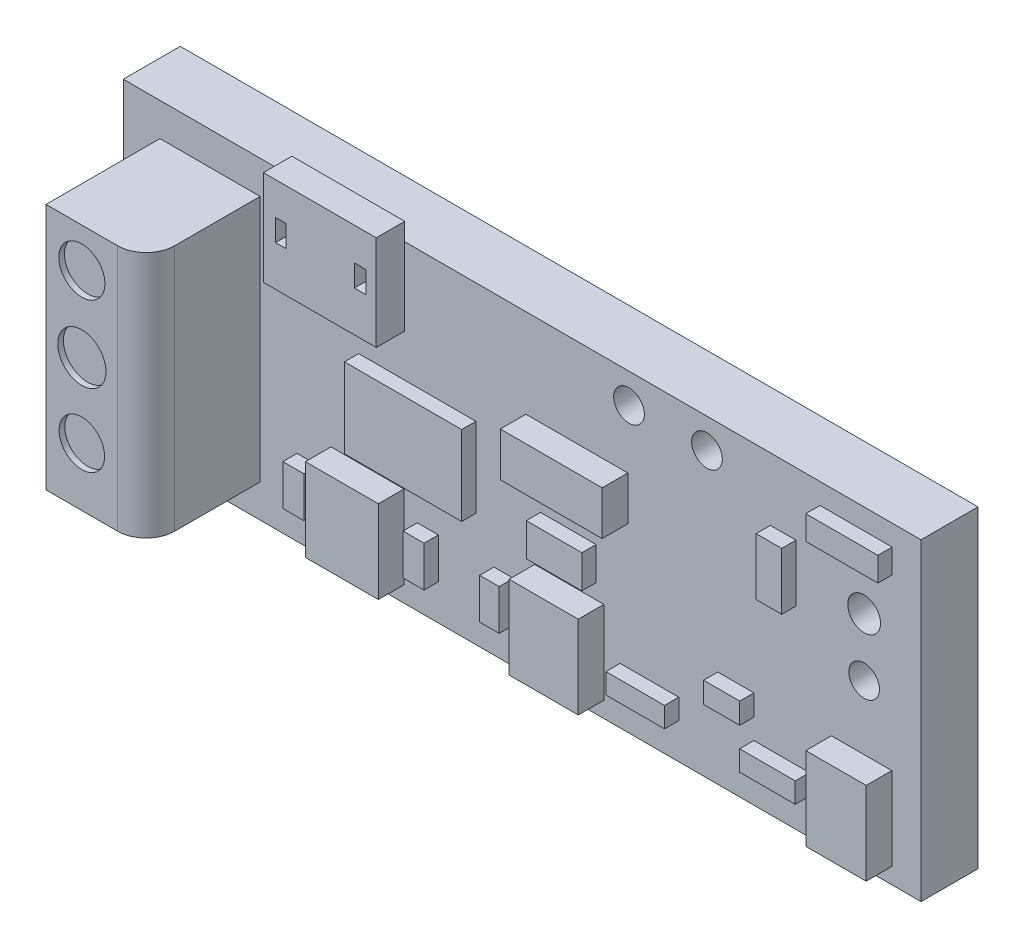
SolidWorks part; units mm, degrees
ref_plane "정면" through (0, 0, 0) normal (0, 0, 1) x (1, 0, 0)
ref_plane "윗면" through (0, 0, 0) normal (0, 1, 0) x (1, 0, 0)
ref_plane "우측면" through (0, 0, 0) normal (1, 0, 0) x (0, 0, -1)
sketch "스케치1" plane through (0, 0, 0) normal (0, 0, 1) x (1, 0, 0)
  line L1 (-16.6516, 33.6659) -> (-13.8516, 33.6659)
  line L2 (-16.6516, 33.6659) -> (-16.6516, 32.5659)
  line L3 (-16.6516, 32.5659) -> (-13.8516, 32.5659)
  line L4 (-13.8516, 33.6659) -> (-13.8516, 32.5659)
  line L5 (-16.6516, 33.6659) -> (-13.8516, 32.5659) construction
  line L6 (-16.6516, 32.5659) -> (-13.8516, 33.6659) construction
  point P0 (-15.2516, 33.1159)
extrude "보스-돌출1" add sketch "스케치1" along normal blind 0.2
sketch "스케치2" plane through (0, 0, 0.2) normal (0, 0, 1) x (1, 0, 0)
  line L1 (-16.5228, 33.5498) -> (-16.1713, 33.5498)
  line L2 (-16.5228, 33.5498) -> (-16.5228, 32.6819)
  line L3 (-16.5228, 32.6819) -> (-16.1713, 32.6819)
  line L4 (-16.1713, 33.5498) -> (-16.1713, 32.6819)
  line L5 (-16.5228, 33.5498) -> (-16.1713, 32.6819) construction
  line L6 (-16.5228, 32.6819) -> (-16.1713, 33.5498) construction
  point P0 (-16.347, 33.1159)
extrude "보스-돌출2" add sketch "스케치2" along normal blind 0.4
fillet "필렛2" radius 0.1 1 edges at (-16.1713, 33.1159, 0.6)
sketch "스케치3" plane through (0, 0, 0.2) normal (0, 0, 1) x (1, 0, 0)
  line L1 (-16.0598, 33.7279) -> (-15.6637, 33.7279)
  line L2 (-16.0598, 33.7279) -> (-16.0598, 33.3943)
  line L3 (-16.0598, 33.3943) -> (-15.6637, 33.3943)
  line L4 (-15.6637, 33.7279) -> (-15.6637, 33.3943)
  line L5 (-16.0598, 33.7279) -> (-15.6637, 33.3943) construction
  line L6 (-16.0598, 33.3943) -> (-15.6637, 33.7279) construction
  point P0 (-15.8617, 33.5611)
extrude "보스-돌출3" add sketch "스케치3" along normal blind 0.1
sketch "스케치4" plane through (0, 0, 0.3) normal (0, 0, 1) x (1, 0, 0)
  line L1 (-16.017, 33.613) -> (-15.9805, 33.613)
  line L2 (-16.017, 33.613) -> (-16.017, 33.5365)
  line L3 (-16.017, 33.5365) -> (-15.9805, 33.5365)
  line L4 (-15.9805, 33.613) -> (-15.9805, 33.5365)
  line L5 (-15.7406, 33.613) -> (-15.6989, 33.613)
  line L6 (-15.7406, 33.613) -> (-15.7406, 33.5365)
  line L7 (-15.7406, 33.5365) -> (-15.6989, 33.5365)
  line L8 (-15.6989, 33.613) -> (-15.6989, 33.5365)
extrude "컷-돌출1" cut sketch "스케치4" against normal blind 0.05
sketch "스케치5" plane through (0, 0, 0.2) normal (0, 0, 1) x (1, 0, 0)
  line L1 (-16.0416, 32.8335) -> (-15.9677, 32.8335)
  line L2 (-16.0416, 32.8335) -> (-16.0416, 32.6911)
  line L3 (-16.0416, 32.6911) -> (-15.9677, 32.6911)
  line L4 (-15.9677, 32.8335) -> (-15.9677, 32.6911)
  line L5 (-15.6196, 32.8335) -> (-15.5458, 32.8335)
  line L6 (-15.6196, 32.8335) -> (-15.6196, 32.6911)
  line L7 (-15.6196, 32.6911) -> (-15.5458, 32.6911)
  line L8 (-15.5458, 32.8335) -> (-15.5458, 32.6911)
  line L9 (-15.3506, 32.8335) -> (-15.2821, 32.8335)
  line L10 (-15.3506, 32.8335) -> (-15.3506, 32.6911)
  line L11 (-15.3506, 32.6911) -> (-15.2821, 32.6911)
  line L12 (-15.2821, 32.8335) -> (-15.2821, 32.6911)
  line L13 (-14.9076, 32.7623) -> (-14.7019, 32.7623)
  line L14 (-14.9076, 32.7623) -> (-14.9076, 32.6911)
  line L15 (-14.9076, 32.6911) -> (-14.7019, 32.6911)
  line L16 (-14.7019, 32.7623) -> (-14.7019, 32.6911)
  line L17 (-14.4382, 32.7623) -> (-14.243, 32.7623)
  line L18 (-14.4382, 32.7623) -> (-14.4382, 32.6911)
  line L19 (-14.4382, 32.6911) -> (-14.243, 32.6911)
  line L20 (-14.243, 32.7623) -> (-14.243, 32.6911)
  line L21 (-14.5647, 32.9073) -> (-14.4382, 32.9073)
  line L22 (-14.5647, 32.9073) -> (-14.5647, 32.8335)
  line L23 (-14.5647, 32.8335) -> (-14.4382, 32.8335)
  line L24 (-14.4382, 32.9073) -> (-14.4382, 32.8335)
  line L25 (-14.3801, 33.4453) -> (-14.2905, 33.4453)
  line L26 (-14.3801, 33.4453) -> (-14.3801, 33.2449)
  line L27 (-14.3801, 33.2449) -> (-14.2905, 33.2449)
  line L28 (-14.2905, 33.4453) -> (-14.2905, 33.2449)
  line L29 (-14.2061, 33.593) -> (-13.9529, 33.593)
  line L30 (-14.2061, 33.593) -> (-14.2061, 33.5086)
  line L31 (-14.2061, 33.5086) -> (-13.9529, 33.5086)
  line L32 (-13.9529, 33.593) -> (-13.9529, 33.5086)
  line L33 (-15.1871, 33.0814) -> (-14.992, 33.0814)
  line L34 (-15.1871, 33.0814) -> (-15.1871, 32.9653)
  line L35 (-15.1871, 32.9653) -> (-14.992, 32.9653)
  line L36 (-14.992, 33.0814) -> (-14.992, 32.9653)
  line L37 (-15.8253, 33.2449) -> (-15.4139, 33.2449)
  line L38 (-15.8253, 33.2449) -> (-15.8253, 32.9653)
  line L39 (-15.8253, 32.9653) -> (-15.4139, 32.9653)
  line L40 (-15.4139, 33.2449) -> (-15.4139, 32.9653)
extrude "보스-돌출4" add sketch "스케치5" along normal blind 0.05
sketch "스케치6" plane through (0, 0, 0.2) normal (0, 0, 1) x (1, 0, 0)
  line L1 (-15.9223, 32.913) -> (-15.6664, 32.913)
  line L2 (-15.9223, 32.913) -> (-15.9223, 32.6217)
  line L3 (-15.9223, 32.6217) -> (-15.6664, 32.6217)
  line L4 (-15.6664, 32.913) -> (-15.6664, 32.6217)
  line L5 (-15.2074, 32.913) -> (-14.9647, 32.913)
  line L6 (-15.2074, 32.913) -> (-15.2074, 32.6217)
  line L7 (-15.2074, 32.6217) -> (-14.9647, 32.6217)
  line L8 (-14.9647, 32.913) -> (-14.9647, 32.6217)
  line L9 (-14.166, 32.913) -> (-13.9542, 32.913)
  line L10 (-14.166, 32.913) -> (-14.166, 32.6217)
  line L11 (-14.166, 32.6217) -> (-13.9542, 32.6217)
  line L12 (-13.9542, 32.913) -> (-13.9542, 32.6217)
  line L13 (-15.2383, 33.3543) -> (-14.8809, 33.3543)
  line L14 (-15.2383, 33.3543) -> (-15.2383, 33.1998)
  line L15 (-15.2383, 33.1998) -> (-14.8809, 33.1998)
  line L16 (-14.8809, 33.3543) -> (-14.8809, 33.1998)
extrude "보스-돌출5" add sketch "스케치6" along normal blind 0.09
sketch "스케치7" plane through (0, 0, 0.2) normal (0, 0, 1) x (1, 0, 0)
  circle A0 centre (-14.8765, 33.5617) radius 0.0539
  circle A1 centre (-14.6029, 33.5617) radius 0.0539
  circle A2 centre (-14.0512, 33.341) radius 0.0575
  circle A3 centre (-14.0512, 33.138) radius 0.0539
extrude "컷-돌출2" cut sketch "스케치7" against normal blind 0.2
sketch "스케치8" plane through (0, 0, 0.6) normal (0, 0, 1) x (1, 0, 0)
  circle A0 centre (-16.397, 33.4116) radius 0.081
  circle A1 centre (-16.397, 33.1469) radius 0.0846
  circle A2 centre (-16.397, 32.8865) radius 0.08
extrude "컷-돌출3" cut sketch "스케치8" against normal blind 0.02
